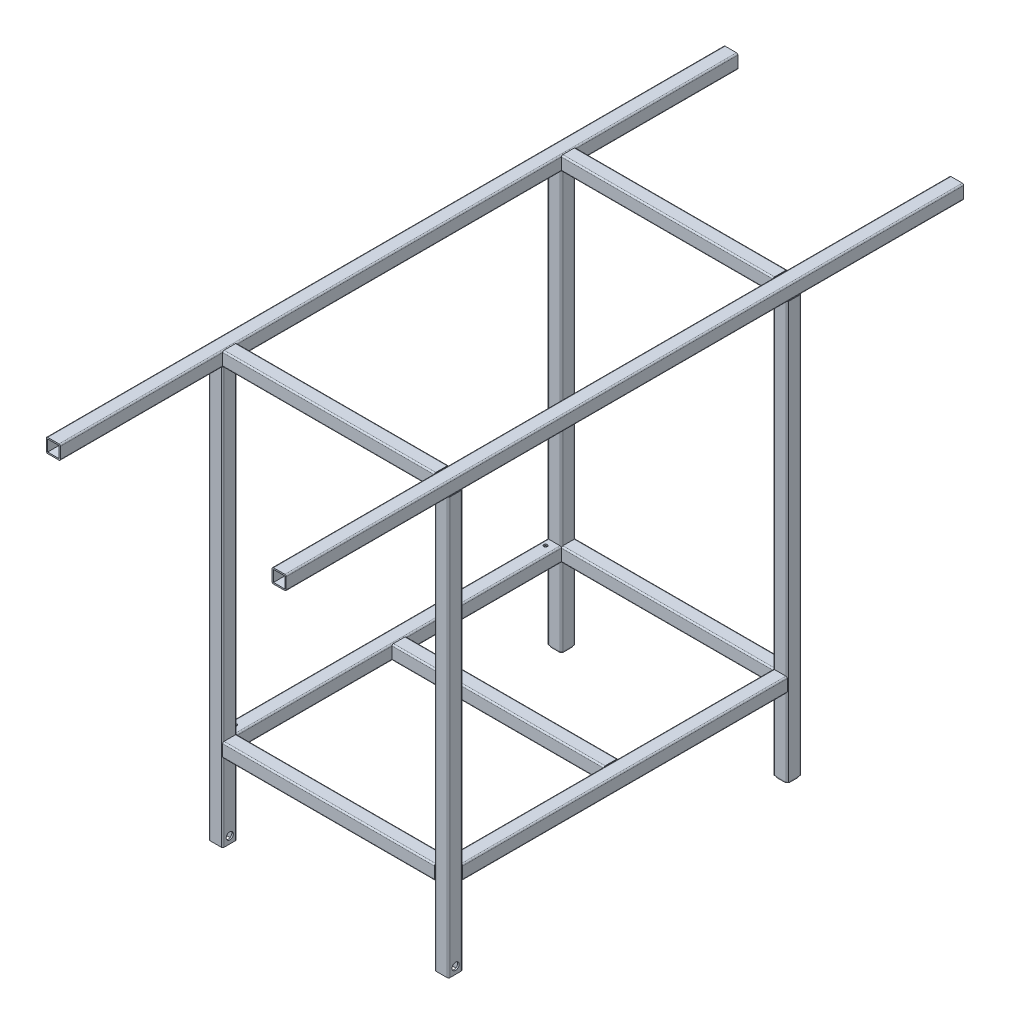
SolidWorks part; units mm, degrees
ref_plane "Front Plane" through (0, 0, 0) normal (0, 0, 1) x (1, 0, 0)
ref_plane "Top Plane" through (0, 0, 0) normal (0, 1, 0) x (1, 0, 0)
ref_plane "Right Plane" through (0, 0, 0) normal (1, 0, 0) x (0, 0, -1)
sketch3d "3DSketch1"
  line L0 (-203.2, 0, -304.8) -> (203.2, 0, 304.8) construction
  line L1 (-203.2, 0, 304.8) -> (-203.2, 0, -304.8)
  line L2 (-203.2, 0, 304.8) -> (203.2, 0, 304.8)
  line L3 (203.2, 0, 304.8) -> (203.2, 0, -304.8)
  line L4 (-203.2, 0, -304.8) -> (203.2, 0, -304.8)
  line L5 (-203.2, 609.6, 304.8) -> (-203.2, -152.4, 304.8)
  line L6 (203.2, -152.4, 304.8) -> (203.2, 609.6, 304.8)
  line L7 (203.2, -152.4, -304.8) -> (203.2, 609.6, -304.8)
  line L8 (-203.2, -152.4, -304.8) -> (-203.2, 609.6, -304.8)
  line L9 (-203.2, 609.6, 609.6) -> (-203.2, 609.6, -609.6)
  line L10 (203.2, 609.6, -609.6) -> (203.2, 609.6, 609.6)
  line L11 (-203.2, 0, 0) -> (-203.2, 609.6, 0) construction
  line L12 (203.2, 609.6, 0) -> (203.2, 0, 0) construction
  line L13 (-203.2, 609.6, 304.8) -> (203.2, 609.6, 304.8)
  line L14 (-203.2, 609.6, -304.8) -> (203.2, 609.6, -304.8)
  line L15 (-203.2, 0, 0) -> (203.2, 0, 0)
  dimension "D1" = 609.6
  dimension "D2" = 406.4
  dimension "D3" = 762
  dimension "D4" = 152.4
  dimension "D5" = 152.4
  dimension "D6" = 152.4
  dimension "D7" = 152.4
  dimension "D8" = 304.8
other "Structural Member1"
ref_plane "Plane1" through (-203.2, -152.4, -304.8) normal (0, 1, 0) x (-1, 0, 0)
sketch "Sketch1" plane through (-203.2, -152.4, -304.8) normal (0, 1, 0) x (-1, 0, 0)
  line L0 (-10.16, 10.16) -> (10.16, 10.16)
  line L1 (-10.16, -12.7) -> (10.16, -12.7)
  line L2 (-12.7, -10.16) -> (-12.7, 10.16)
  line L3 (-10.16, 12.7) -> (10.16, 12.7)
  line L4 (12.7, -10.16) -> (12.7, 10.16)
  line L5 (-12.7, -12.7) -> (12.7, 12.7) construction
  line L6 (-12.7, 12.7) -> (12.7, -12.7) construction
  line L7 (10.16, -10.16) -> (10.16, 10.16)
  line L8 (-10.16, -10.16) -> (10.16, -10.16)
  line L9 (-10.16, -10.16) -> (-10.16, 10.16)
  arc A0 (-12.7, 10.16) -> (-10.16, 12.7) centre (-10.16, 10.16) cw
  arc A1 (10.16, 12.7) -> (12.7, 10.16) centre (10.16, 10.16) cw
  arc A2 (10.16, -12.7) -> (12.7, -10.16) centre (10.16, -10.16) ccw
  arc A3 (-10.16, -12.7) -> (-12.7, -10.16) centre (-10.16, -10.16) cw
  arc A4 (10.16, 10.16) -> (10.16, 10.16) centre (10.16, 10.16) cw
  arc A5 (10.16, -10.16) -> (10.16, -10.16) centre (10.16, -10.16) ccw
  arc A6 (-10.16, -10.16) -> (-10.16, -10.16) centre (-10.16, -10.16) cw
  arc A7 (-10.16, 10.16) -> (-10.16, 10.16) centre (-10.16, 10.16) cw
  point P0 (0, 0)
  point P30 (0, 0)
  dimension "D2" = 2.54
  dimension "D1" = 25.4
  dimension "D3" = 2.54
other "Structural Member2"
ref_plane "Plane2" through (-203.2, 0, 304.8) normal (0, 0, -1) x (-1, 0, 0)
sketch "Sketch11" plane through (-203.2, 0, 304.8) normal (0, 0, -1) x (-1, 0, 0)
  line L0 (-10.16, 10.16) -> (10.16, 10.16)
  line L1 (-10.16, -12.7) -> (10.16, -12.7)
  line L2 (-12.7, -10.16) -> (-12.7, 10.16)
  line L3 (-10.16, 12.7) -> (10.16, 12.7)
  line L4 (12.7, -10.16) -> (12.7, 10.16)
  line L5 (-12.7, -12.7) -> (12.7, 12.7) construction
  line L6 (-12.7, 12.7) -> (12.7, -12.7) construction
  line L7 (10.16, -10.16) -> (10.16, 10.16)
  line L8 (-10.16, -10.16) -> (10.16, -10.16)
  line L9 (-10.16, -10.16) -> (-10.16, 10.16)
  arc A0 (-12.7, 10.16) -> (-10.16, 12.7) centre (-10.16, 10.16) cw
  arc A1 (10.16, 12.7) -> (12.7, 10.16) centre (10.16, 10.16) cw
  arc A2 (10.16, -12.7) -> (12.7, -10.16) centre (10.16, -10.16) ccw
  arc A3 (-10.16, -12.7) -> (-12.7, -10.16) centre (-10.16, -10.16) cw
  arc A4 (10.16, 10.16) -> (10.16, 10.16) centre (10.16, 10.16) cw
  arc A5 (10.16, -10.16) -> (10.16, -10.16) centre (10.16, -10.16) ccw
  arc A6 (-10.16, -10.16) -> (-10.16, -10.16) centre (-10.16, -10.16) cw
  arc A7 (-10.16, 10.16) -> (-10.16, 10.16) centre (-10.16, 10.16) cw
  point P0 (0, 0)
  point P30 (0, 0)
  dimension "D2" = 2.54
  dimension "D1" = 25.4
  dimension "D3" = 2.54
other "Structural Member3"
ref_plane "Plane3" through (-203.2, 609.6, 609.6) normal (0, 0, -1) x (-1, 0, 0)
sketch "Sketch12" plane through (-203.2, 609.6, 609.6) normal (0, 0, -1) x (-1, 0, 0)
  line L0 (-10.16, 10.16) -> (10.16, 10.16)
  line L1 (-10.16, -12.7) -> (10.16, -12.7)
  line L2 (-12.7, -10.16) -> (-12.7, 10.16)
  line L3 (-10.16, 12.7) -> (10.16, 12.7)
  line L4 (12.7, -10.16) -> (12.7, 10.16)
  line L5 (-12.7, -12.7) -> (12.7, 12.7) construction
  line L6 (-12.7, 12.7) -> (12.7, -12.7) construction
  line L7 (10.16, -10.16) -> (10.16, 10.16)
  line L8 (-10.16, -10.16) -> (10.16, -10.16)
  line L9 (-10.16, -10.16) -> (-10.16, 10.16)
  arc A0 (-12.7, 10.16) -> (-10.16, 12.7) centre (-10.16, 10.16) cw
  arc A1 (10.16, 12.7) -> (12.7, 10.16) centre (10.16, 10.16) cw
  arc A2 (10.16, -12.7) -> (12.7, -10.16) centre (10.16, -10.16) ccw
  arc A3 (-10.16, -12.7) -> (-12.7, -10.16) centre (-10.16, -10.16) cw
  arc A4 (10.16, 10.16) -> (10.16, 10.16) centre (10.16, 10.16) cw
  arc A5 (10.16, -10.16) -> (10.16, -10.16) centre (10.16, -10.16) ccw
  arc A6 (-10.16, -10.16) -> (-10.16, -10.16) centre (-10.16, -10.16) cw
  arc A7 (-10.16, 10.16) -> (-10.16, 10.16) centre (-10.16, 10.16) cw
  point P0 (0, 0)
  point P30 (0, 0)
  dimension "D2" = 2.54
  dimension "D1" = 25.4
  dimension "D3" = 2.54
other "Trim/Extend1"
other "Trim/Extend2"
other "Trim/Extend3"
other "End cap1" parameters "D1"=2.54, "D2"=3.175, "D3"=3.175
other "End cap2" parameters "D1"=2.54, "D2"=3.175, "D3"=3.175
sketch "Sketch13" plane through (0, -154.94, 0) normal (0, -1, 0) x (1, 0, 0)
  line L0 (214.63, -304.8) -> (191.77, -304.8) construction
  line L1 (214.63, -313.055) -> (214.63, -296.545) construction
  line L2 (191.77, -296.545) -> (191.77, -313.055) construction
  line L3 (-191.77, -304.8) -> (-214.63, -304.8) construction
  line L4 (-191.77, -313.055) -> (-191.77, -296.545) construction
  line L5 (-214.63, -296.545) -> (-214.63, -313.055) construction
  circle A0 centre (-203.2, -304.8) radius 3.81
  circle A1 centre (203.2, -304.8) radius 3.81
  dimension "D1" = 7.62
extrude "Extrude1" cut sketch "Sketch13" against normal up to next
sketch "Sketch14" plane through (215.9, 0, 0) normal (1, 0, 0) x (0, 0, -1)
  line L0 (-304.8, -152.4) -> (-304.8, -127) construction
  line L1 (-314.96, -152.4) -> (-294.64, -152.4) construction
  line L2 (-317.5, -127) -> (-292.1, -127) construction
  line L3 (-317.5, 596.9) -> (-317.5, -152.4) construction
  line L4 (-292.1, 596.9) -> (-292.1, -152.4) construction
  circle A0 centre (-304.8, -139.7) radius 6.35
  dimension "D2" = 12.7
  dimension "D1" = 25.4
extrude "Extrude2" cut sketch "Sketch14" against normal through all
sketch "Sketch17" plane through (0, 12.7, 0) normal (0, 1, 0) x (1, 0, 0)
  line L0 (-193.04, 292.1) -> (-213.36, 292.1) construction
  line L2 (-215.9, 292.1) -> (-215.9, -292.1) construction
  circle A0 centre (-206.375, 279.4) radius 3.175
  dimension "D1" = 6.35
  dimension "D2" = 12.7
  dimension "D3" = 9.525
extrude "Cut-Extrude1" cut sketch "Sketch17" against normal up to next
mirror "Mirror1" about plane through (0, 0, 0) normal (0, 0, 1) of "Cut-Extrude1"
other "Structural Member5"
ref_plane "Plane5" through (-203.2, 0, 0) normal (1, 0, 0) x (0, 0, -1)
sketch "Sketch19" plane through (-203.2, 0, 0) normal (1, 0, 0) x (0, 0, -1)
  line L0 (10.16, 10.16) -> (-10.16, 10.16)
  line L1 (10.16, -12.7) -> (-10.16, -12.7)
  line L2 (12.7, -10.16) -> (12.7, 10.16)
  line L3 (10.16, 12.7) -> (-10.16, 12.7)
  line L4 (-12.7, -10.16) -> (-12.7, 10.16)
  line L5 (12.7, -12.7) -> (-12.7, 12.7) construction
  line L6 (12.7, 12.7) -> (-12.7, -12.7) construction
  line L7 (-10.16, -10.16) -> (-10.16, 10.16)
  line L8 (10.16, -10.16) -> (-10.16, -10.16)
  line L9 (10.16, -10.16) -> (10.16, 10.16)
  arc A0 (-10.16, 12.7) -> (-12.7, 10.16) centre (-10.16, 10.16) ccw
  arc A1 (12.7, 10.16) -> (10.16, 12.7) centre (10.16, 10.16) ccw
  arc A2 (10.16, -12.7) -> (12.7, -10.16) centre (10.16, -10.16) ccw
  arc A3 (-10.16, -12.7) -> (-12.7, -10.16) centre (-10.16, -10.16) cw
  arc A4 (-10.16, 10.16) -> (-10.16, 10.16) centre (-10.16, 10.16) ccw
  arc A5 (-10.16, -10.16) -> (-10.16, -10.16) centre (-10.16, -10.16) cw
  arc A6 (10.16, -10.16) -> (10.16, -10.16) centre (10.16, -10.16) ccw
  arc A7 (10.16, 10.16) -> (10.16, 10.16) centre (10.16, 10.16) ccw
  point P0 (0, 0)
  point P30 (0, 0)
  dimension "D1" = 2.54
  dimension "D3" = 25.4
  dimension "D2" = 2.54
other "Trim/Extend4"
